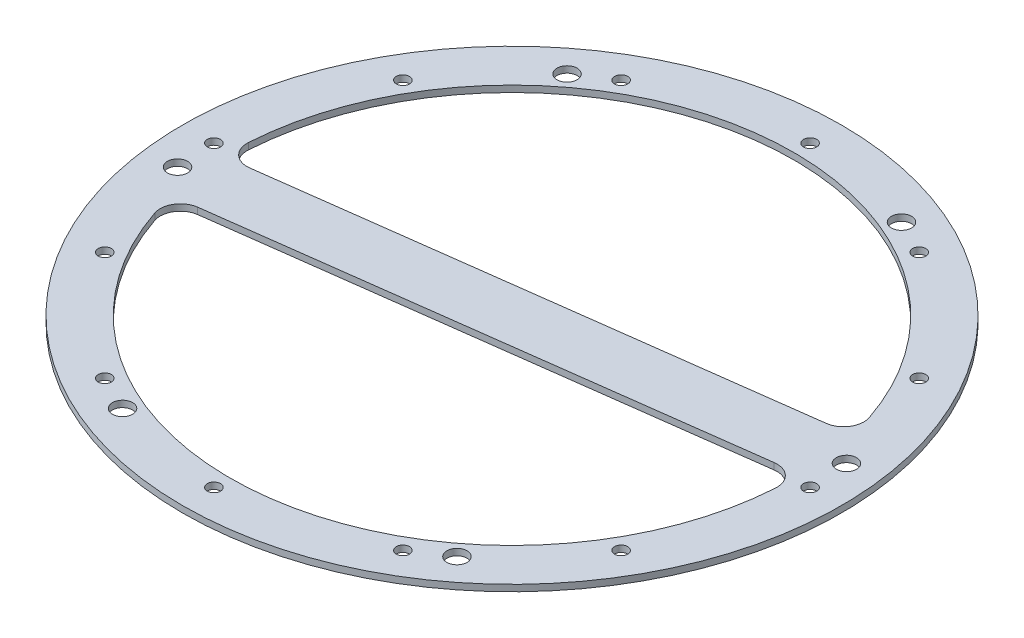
SolidWorks part; units mm, degrees
ref_plane "Front Plane" through (0, 0, 0) normal (0, 0, 1) x (1, 0, 0)
ref_plane "Top Plane" through (0, 0, 0) normal (0, 1, 0) x (1, 0, 0)
ref_plane "Right Plane" through (0, 0, 0) normal (1, 0, 0) x (0, 0, -1)
sketch "Sketch1" plane through (0, 0, 0) normal (0, 1, 0) x (1, 0, 0)
  line L0 (-69.8809, -1.6353) -> (67.923, 16.5069)
  line L1 (-67.923, -16.5069) -> (69.8809, 1.6353)
  line L2 (0, 0) -> (-0.9789, 7.4358) construction
  line L3 (0, 0) -> (0.9789, -7.4358) construction
  line L4 (0, 0) -> (29.9574, 0) construction
  circle A0 centre (0, 0) radius 81.7
  circle A1 centre (0, 0) radius 69.9 construction
  arc A2 (-69.8809, -1.6353) -> (67.923, 16.5069) centre (0, 0) cw
  arc A3 (-67.923, -16.5069) -> (69.8809, 1.6353) centre (0, 0) ccw
  dimension "D1" = 163.4
  dimension "D2" = 139.8
  dimension "D3" = 15
  dimension "D4" = 7.5
extrude "Boss-Extrude1" add sketch "Sketch1" along normal blind 1.6
hole_wizard "#4 Clearance Hole1" positions "Sketch2" profile "Sketch3" hole size "#4" standard "ANSI Inch"
sketch "Sketch2" plane through (0, 1.6, 0) normal (0, 1, 0) x (1, 0, 0)
  line L0 (0, 0) -> (73.9, 0) construction
  line L2 (0, 0) -> (63.9993, 36.95) construction
  line L4 (0, 0) -> (-63.9993, -36.95) construction
  point P0 (73.9, 0)
  point P12 (63.9993, -36.95)
  point P13 (36.95, -63.9993)
  point P14 (0, -73.9)
  point P15 (-36.95, -63.9993)
  point P16 (-63.9993, -36.95)
  point P17 (-73.9, 0)
  point P18 (-63.9993, 36.95)
  point P19 (-36.95, 63.9993)
  point P20 (0, 73.9)
  point P21 (36.95, 63.9993)
  point P22 (63.9993, 36.95)
  dimension "D1" = 73.9
  dimension "D2" = 12
sketch "Sketch3" plane through (73.9, 1.6, 0) normal (1, 0, 0) x (0, 0, 1)
  line L0 (0, 0) -> (0, 1.6)
  line L1 (0, 1.6) -> (1.6319, 1.6)
  line L2 (1.6319, 1.6) -> (1.6319, 0)
  line L5 (1.6319, 0) -> (0, 0)
  line L11 (0, -6.35) -> (0, 107.95) construction
  dimension "Thru Hole Dia." = 3.2639
  dimension "Thru Hole Depth" = 1.6
hole_wizard "Ø5.0mm Dowel Hole1" positions "Sketch4" profile "Sketch5" hole size "Ø5.0" standard "ANSI Metric"
sketch "Sketch4" plane through (0, 1.6, 0) normal (0, 1, 0) x (1, 0, 0)
  line L0 (0, 0) -> (73.9, 0) construction
  line L2 (0, 0) -> (73.2678, 9.6459) construction
  line L3 (28.2803, 68.2747) -> (0, 0) construction
  line L4 (0, 0) -> (-28.2803, -68.2747) construction
  point P0 (73.2678, 9.6459)
  point P18 (44.9875, -58.6288)
  point P19 (-28.2803, -68.2747)
  point P20 (-73.2678, -9.6459)
  point P21 (-44.9875, 58.6288)
  point P22 (28.2803, 68.2747)
  dimension "D1" = 7.5
  dimension "D2" = 6
sketch "Sketch5" plane through (73.2678, 1.6, -9.6459) normal (1, 0, 0) x (0, 0, 1)
  line L0 (0, 0) -> (0, 1.6)
  line L1 (0, 1.6) -> (2.5, 1.6)
  line L2 (2.5, 1.6) -> (2.5, 0)
  line L5 (2.5, 0) -> (0, 0)
  line L11 (0, -6.35) -> (0, 107.95) construction
  dimension "Thru Hole Dia." = 5
  dimension "Thru Hole Depth" = 1.6
fillet "Fillet1" radius 5 4 edges at (-69.8809, 0.8, 1.6353) (67.923, 0.8, -16.5069) (-67.923, 0.8, 16.5069) (69.8809, 0.8, -1.6353)
